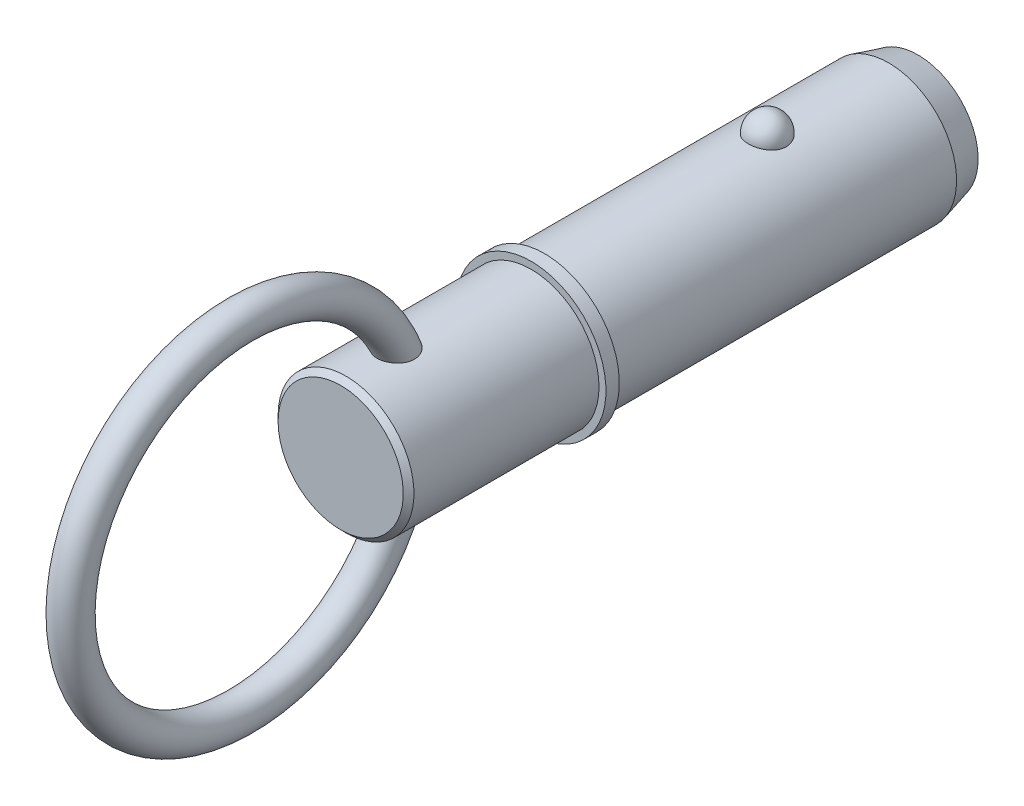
SolidWorks part; units mm, degrees
ref_plane "Front Plane" through (0, 0, 0) normal (0, 0, 1) x (1, 0, 0)
ref_plane "Top Plane" through (0, 0, 0) normal (0, 1, 0) x (1, 0, 0)
ref_plane "Right Plane" through (0, 0, 0) normal (1, 0, 0) x (0, 0, -1)
sketch "Sketch2" plane through (0, 0, 0) normal (0, 0, 1) x (1, 0, 0)
  circle A0 centre (0, 0) radius 12.7
  point P3 (0, 12.7)
  dimension "D1" = 25.4
extrude "Boss-Extrude1" add sketch "Sketch2" along normal blind 38.1
sketch "Sketch3" plane through (0, 0, 0) normal (0, 0, -1) x (-1, 0, 0)
  circle A0 centre (0, 0) radius 12.7
  dimension "D1" = 25.4
extrude "Boss-Extrude2" add sketch "Sketch3" along normal blind 31.75
chamfer "Chamfer1" distance 5.5 angle 15 1 edges at (-12.7, 0, -31.75)
sketch "Sketch18" plane through (0, 0, 0) normal (1, 0, 0) x (0, 0, -1)
  line L0 (26.25, 12.7) -> (-38.1, 12.7) construction
  line L1 (3.56, 16.26) -> (3.56, 9.14)
  line L2 (-38.1, -12.7) -> (26.25, -12.7) construction
  arc A0 (3.56, 16.26) -> (3.56, 9.14) centre (3.56, 12.7) ccw
  point P4 (0, 12.7)
  dimension "D1" = 28.96
revolve "Revolve1" add sketch "Sketch18" angle 360 about L1
sketch "Sketch19" plane through (0, 0, 0) normal (1, 0, 0) x (0, 0, -1)
  line L0 (-33.7288, 0) -> (-46.4542, 0) construction
sketch "Sketch20" plane through (0, 0, 0) normal (1, 0, 0) x (0, 0, -1)
  line L0 (-38.1, 0) -> (-38.1, 14)
  line L1 (-38.1, 12.7) -> (-38.1, -12.7) construction
  line L2 (-38.1, 14) -> (-40.6, 14)
  line L3 (-40.6, 14) -> (-40.6, 0)
  line L4 (-33.7288, 0) -> (-46.4542, 0) construction
  line L5 (-40.6, 0) -> (-38.1, 0)
  dimension "D1" = 14
  dimension "D2" = 2.5
revolve "Revolve2" add sketch "Sketch20" angle 360 about L0
sketch "Sketch21" plane through (0, 0, 38.1) normal (0, 0, -1) x (-1, 0, 0)
  circle A0 centre (0, 0) radius 12.7
  dimension "D1" = 25.4
extrude "Boss-Extrude3" add sketch "Sketch21" against normal blind 38.1
chamfer "Chamfer2" distance 1 angle 45 1 edges at (-12.7, 0, 76.2)
sketch "Sketch23" plane through (0, 0, 0) normal (1, 0, 0) x (0, 0, -1)
  line L0 (-76.2, 11.7) -> (-76.2, -11.7) construction
  circle A0 centre (-94.95, 0) radius 31.75
  point P2 (-63.2, 0)
  dimension "D1" = 63.5
  dimension "D2" = 13
sketch "Sketch24" plane through (0, 0, 0) normal (0, 1, 0) x (1, 0, 0)
  circle A0 centre (0, -63.2) radius 3.25
  dimension "D1" = 6.5
sweep "Sweep1" add profiles "Sketch24" path "Sketch23"
